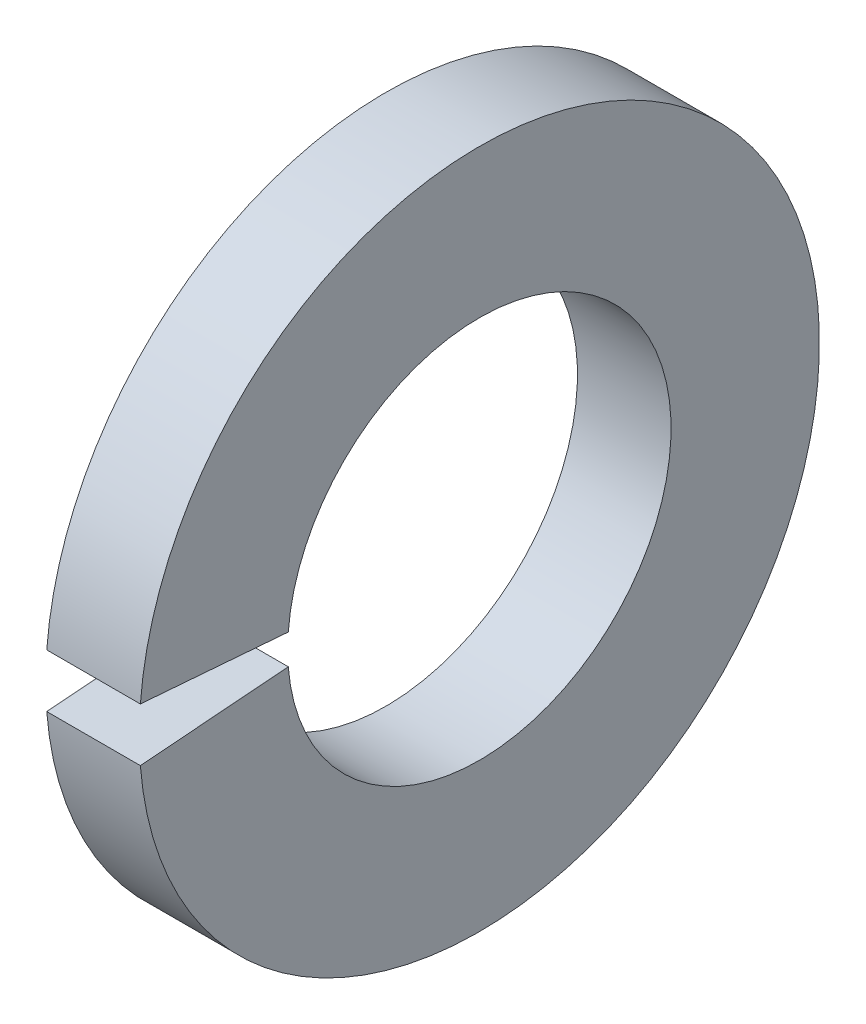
SolidWorks part; units mm, degrees
ref_plane "Plane1" through (0, 0, 0) normal (0, 0, 1) x (1, 0, 0)
ref_plane "Plane2" through (0, 0, 0) normal (0, 1, 0) x (1, 0, 0)
ref_plane "Plane3" through (0, 0, 0) normal (1, 0, 0) x (0, 0, -1)
sketch "Sketch1" plane through (0, 0, 0) normal (0, 0, 1) x (1, 0, 0)
  line L0 (-34.925, 0) -> (9.525, 0) construction
  line L1 (0, 4.8895) -> (0, 8.6741)
  line L2 (0, 8.6741) -> (-2.3876, 8.6741)
  line L3 (-2.3876, 8.6741) -> (-2.3876, 4.8895)
  line L4 (-2.3876, 4.8895) -> (0, 4.8895)
revolve "Base-Revolve" add sketch "Sketch1" angle 360 about L0
sketch "Sketch2" plane through (0, 0, 0) normal (-1, 0, 0) x (0, -1, 0)
  line L0 (0, 0) -> (0.6942, 8.8203)
  line L1 (0, -3.175) -> (0, 12.7) construction
  line L2 (0, 0) -> (-0.6942, 8.8203)
  arc A0 (0.6942, 8.8203) -> (-0.6942, 8.8203) centre (0, 0) ccw
extrude "Gap" cut sketch "Sketch2" along normal through all
equation "\"D1@Sketch2\" = \"Outside_dia@Sketch1\" * 0.51"
